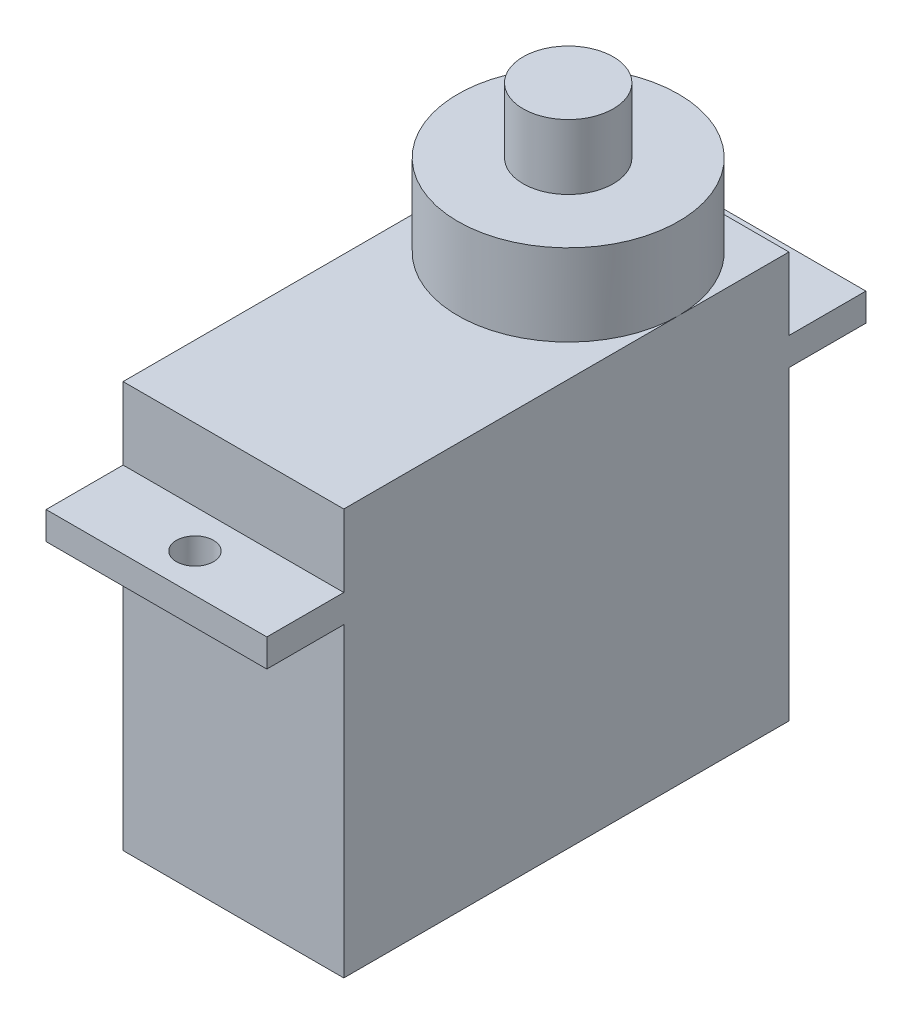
SolidWorks part; units mm, degrees
ref_plane "Front Plane" through (0, 0, 0) normal (0, 0, 1) x (1, 0, 0)
ref_plane "Top Plane" through (0, 0, 0) normal (0, 1, 0) x (1, 0, 0)
ref_plane "Right Plane" through (0, 0, 0) normal (1, 0, 0) x (0, 0, -1)
sketch "Sketch1" plane through (0, 0, 0) normal (0, 1, 0) x (1, 0, 0)
  line L1 (-5.95, 12) -> (5.95, 12)
  line L2 (-5.95, 12) -> (-5.95, -12)
  line L3 (-5.95, -12) -> (5.95, -12)
  line L4 (5.95, 12) -> (5.95, -12)
  line L5 (-5.95, 12) -> (5.95, -12) construction
  line L6 (-5.95, -12) -> (5.95, 12) construction
  point P0 (0, 0)
  dimension "D1" = 11.9
  dimension "D2" = 24
extrude "Boss-Extrude1" add sketch "Sketch1" along normal blind 16.5
sketch "Sketch2" plane through (0, 16.5, 0) normal (0, 1, 0) x (1, 0, 0)
  line L1 (-5.95, 16.15) -> (5.95, 16.15)
  line L2 (-5.95, 16.15) -> (-5.95, -16.15)
  line L3 (-5.95, -16.15) -> (5.95, -16.15)
  line L4 (5.95, 16.15) -> (5.95, -16.15)
  line L5 (-5.95, 16.15) -> (5.95, -16.15) construction
  line L6 (-5.95, -16.15) -> (5.95, 16.15) construction
  point P0 (0, 0)
  dimension "D1" = 11.9
  dimension "D2" = 32.3
extrude "Boss-Extrude2" add sketch "Sketch2" along normal blind 1.5 contours L2 L3 L4 L1
sketch "Sketch3" plane through (0, 18, 0) normal (0, 1, 0) x (1, 0, 0)
  line L1 (-5.95, 12) -> (5.95, 12)
  line L2 (-5.95, 12) -> (-5.95, -12)
  line L3 (-5.95, -12) -> (5.95, -12)
  line L4 (5.95, 12) -> (5.95, -12)
  line L5 (-5.95, 12) -> (5.95, -12) construction
  line L6 (-5.95, -12) -> (5.95, 12) construction
  point P0 (0, 0)
  dimension "D1" = 11.9
  dimension "D2" = 24
extrude "Boss-Extrude3" add sketch "Sketch3" along normal blind 3.9 contours L1 L4 L3 L2
sketch "Sketch4" plane through (0, 21.9, 0) normal (0, 1, 0) x (1, 0, 0)
  line L0 (-5.95, 12) -> (5.95, 12) construction
  circle A0 centre (0, 6.05) radius 5.95
  dimension "D1" = 11.9
  dimension "D2" = 5.95
extrude "Boss-Extrude4" add sketch "Sketch4" along normal blind 4.4
sketch "Sketch5" plane through (0, 26.3, 0) normal (0, 1, 0) x (1, 0, 0)
  circle A0 centre (0, 6.05) radius 2.43
  dimension "D1" = 4.86
extrude "Boss-Extrude5" add sketch "Sketch5" along normal blind 3.5
sketch "Sketch6" plane through (0, 18, 0) normal (0, 1, 0) x (1, 0, 0)
  circle A0 centre (0, -14.075) radius 1
  circle A1 centre (0, 14.075) radius 1
  dimension "D1" = 2
  dimension "D2" = 2
extrude "Cut-Extrude1" cut sketch "Sketch6" against normal through all
sketch "Sketch7" plane through (0, 0, -12) normal (0, 0, -1) x (-1, 0, 0)
  line L1 (-2, 3) -> (2, 3)
  line L2 (-2, 3) -> (-2, 0)
  line L3 (-2, 0) -> (2, 0)
  line L4 (2, 3) -> (2, 0)
  line L5 (-2, 3) -> (2, 0) construction
  line L6 (-2, 0) -> (2, 3) construction
  line L7 (-5.95, 0) -> (5.95, 0) construction
  point P0 (0, 1.5)
  dimension "D1" = 1.5
  dimension "D2" = 3
  dimension "D3" = 4
extrude "Cut-Extrude2" cut sketch "Sketch7" against normal blind 3.5
